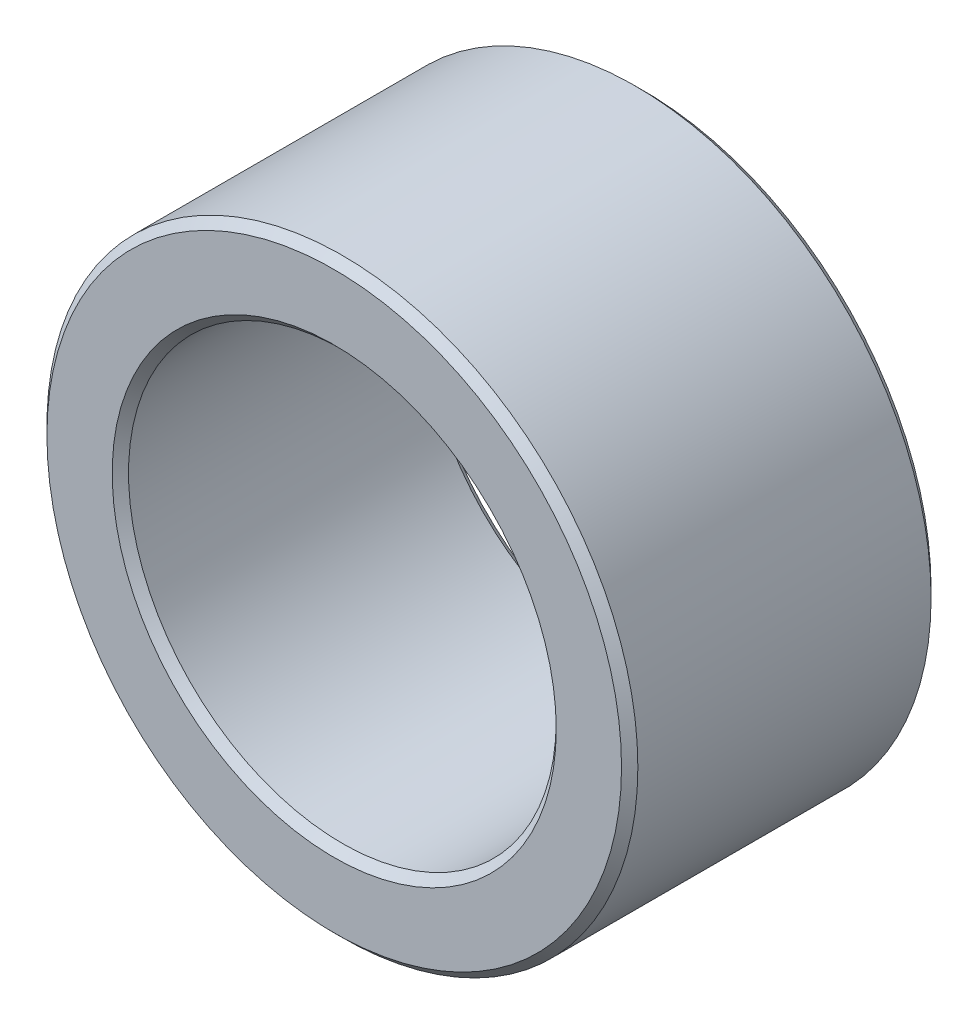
SolidWorks part; units mm, degrees
other "Defeature"
ref_plane "Front Plane" through (0, 0, 0) normal (0, 0, 1) x (1, 0, 0)
ref_plane "Top Plane" through (0, 0, 0) normal (0, 1, 0) x (1, 0, 0)
ref_plane "Right Plane" through (0, 0, 0) normal (1, 0, 0) x (0, 0, -1)
sketch "Sketch1" plane through (0, 0, 0) normal (0, 0, 1) x (1, 0, 0)
  circle A0 centre (0, 0) radius 6.6675 construction
  circle A1 centre (0, 0) radius 4.826 construction
  point P4 (0, 6.6675)
sketch "Sketch2" plane through (0, 0, 0) normal (1, 0, 0) x (0, 0, -1)
  line L0 (-3.4925, 6.6675) -> (3.4925, 6.6675) construction
  dimension "Length" = 6.985
sketch "Sketch3" plane through (0, 0, 0) normal (0, 0, 1) x (1, 0, 0)
  circle A0 centre (0, 0) radius 4.826 construction
  circle A1 centre (0, 0) radius 6.6675 construction
  circle A2 centre (0, 0) radius 4.826
  circle A3 centre (0, 0) radius 6.6675
extrude "Boss-Extrude1" add sketch "Sketch3" against normal up to vertex (3.4925 mm away) and the other way up to vertex (3.4925 mm away)
chamfer "Chamfer1" distance 0.1842 angle 45 4 edges at (6.6675, 0, 3.4925) (6.6675, 0, -3.4925) (4.826, 0, 3.4925) (4.826, 0, -3.4925)
equation "\"D1@Chamfer1\"=(\"OD@Sketch1\"-\"ID@Sketch1\")*0.05"
